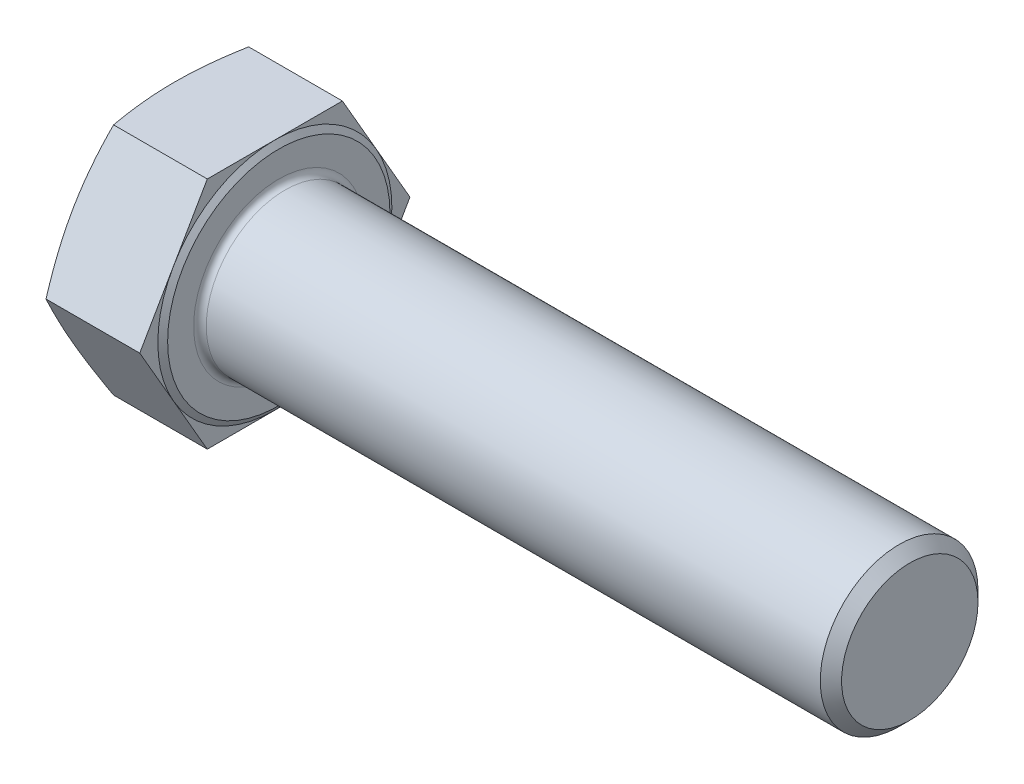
SolidWorks part; units mm, degrees
ref_plane "Front" through (0, 0, 0) normal (0, 0, 1) x (1, 0, 0)
ref_plane "Top" through (0, 0, 0) normal (0, 1, 0) x (1, 0, 0)
ref_plane "Right" through (0, 0, 0) normal (1, 0, 0) x (0, 0, -1)
sketch "Sketch-BaseHead" plane through (0, 0, 0) normal (1, 0, 0) x (0, 0, -1)
  line L1 (17.13, 0) -> (8.565, 14.835)
  line L2 (8.565, 14.835) -> (-8.565, 14.835)
  line L3 (-8.565, 14.835) -> (-17.13, 0)
  line L4 (-17.13, 0) -> (-8.565, -14.835)
  line L5 (-8.565, -14.835) -> (8.565, -14.835)
  line L6 (8.565, -14.835) -> (17.13, 0)
  circle A0 centre (0, 0) radius 14.835 construction
  dimension "s" = 29.67
extrude "BaseHead" add sketch "Sketch-BaseHead" along normal blind 12.72
sketch "Sketch4" plane through (-0.2646, 0, 5.9169) normal (0, 1, 0) x (0, 0, -1)
  line L0 (5.9169, 3.7369) -> (5.9169, -10.4477) construction
  line L2 (23.0469, -0.2646) -> (20.7519, -0.2646)
  line L4 (20.7519, -0.2646) -> (23.0469, -1.0999)
  line L6 (23.0469, -1.0999) -> (23.0469, -0.2646)
  dimension "D1" = 20
  dimension "D2" = 29.67
revolve "HeadChamfer" cut sketch "Sketch4" angle 360 about L0
sketch "Sketch1" plane through (0, 0, 0) normal (0, 0, 1) x (1, 0, 0)
  line L0 (12.72, 0) -> (13.22, 0)
  line L1 (13.22, 0) -> (13.22, -14.095)
  line L2 (13.22, -14.095) -> (12.72, -14.835)
  line L3 (12.72, -14.835) -> (12.72, 0) construction
  line L4 (0, 0) -> (7.5821, 0) construction
  line L5 (-4.0016, 0) -> (10.1831, 0) construction
  line L6 (12.72, -14.835) -> (0.8353, -14.835) construction
  line L7 (12.72, 0) -> (12.72, -14.835)
  dimension "D1" = 14.835
  dimension "c" = 0.5
  dimension "D2" = 14.095
revolve "Revolve1" add sketch "Sketch1" angle 360 about axis through (-4.0016, 0, 0) along (1, 0, 0)
ref_plane "Plane2" through (47.22, 0, 0) normal (1, 0, 0) x (0, 0, -1)
sketch "Sketch3" plane through (13.22, 0, 0) normal (1, 0, 0) x (0, 0, -1)
  circle A0 centre (0, 0) radius 10
  dimension "d" = 20
extrude "BaseBody" add sketch "Sketch3" along normal blind 80
fillet "HeadFillet" radius 0.8 1 edges at (13.22, 0, -10)
chamfer "Chamfer1" distance 1.353 angle 45 1 edges at (93.22, 0, -10)
equation "\"D1@Sketch1\" = \"s@Sketch-BaseHead\"/ 2"
equation "\"D2@Sketch4\" = \"s@Sketch-BaseHead\""
equation "\"D1@Chamfer1\" =  ( \"d@Sketch3\" - \"D2@ThreadCosmetic1\" ) / 2 "
equation "\"b@ThreadCosmetic1\" = \"l@BaseBody\" - \"lg@Plane2\""
